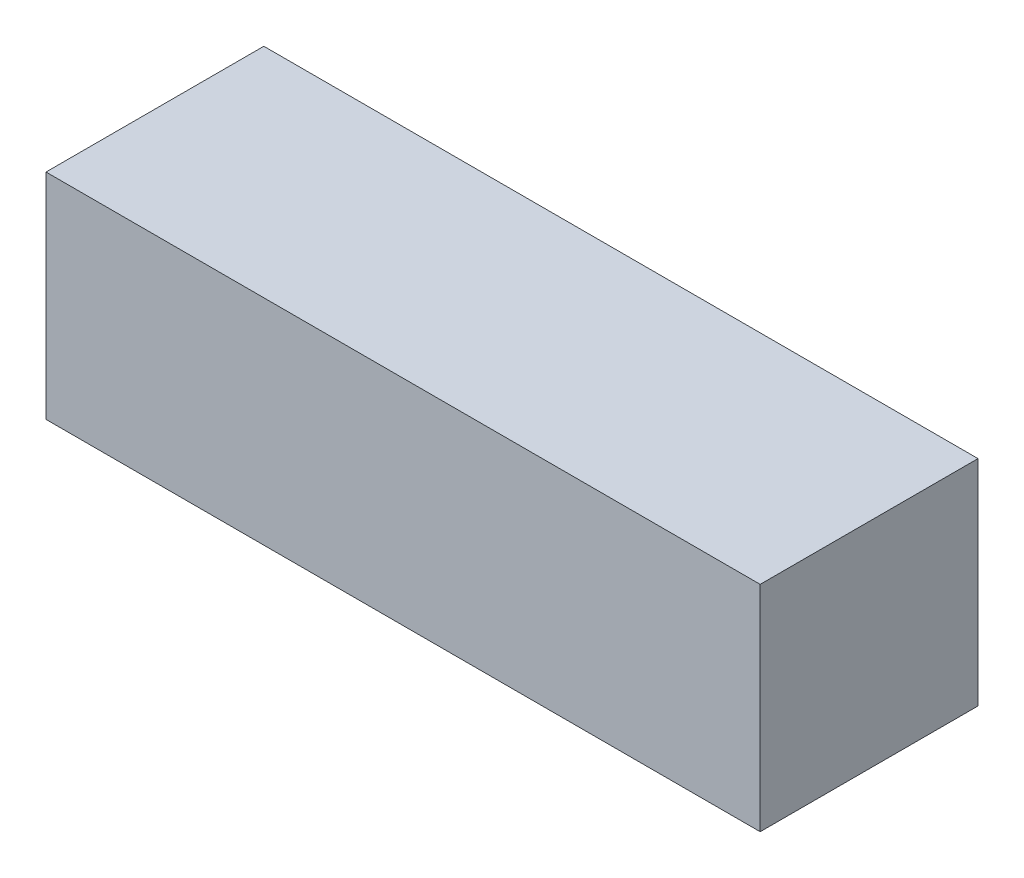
SolidWorks part; units mm, degrees
ref_plane "Front" through (0, 0, 0) normal (0, 0, 1) x (1, 0, 0)
ref_plane "Top" through (0, 0, 0) normal (0, 1, 0) x (1, 0, 0)
ref_plane "Right" through (0, 0, 0) normal (1, 0, 0) x (0, 0, -1)
sketch "Sketch1" plane through (0, 0, 0) normal (0, 0, 1) x (1, 0, 0)
  line L1 (0, 0) -> (200, 0)
  line L2 (0, 0) -> (0, 60)
  line L3 (0, 60) -> (200, 60)
  line L4 (200, 0) -> (200, 60)
  dimension "D1" = 200
  dimension "D2" = 60
extrude "Extrude1" add sketch "Sketch1" along normal mid plane 61
